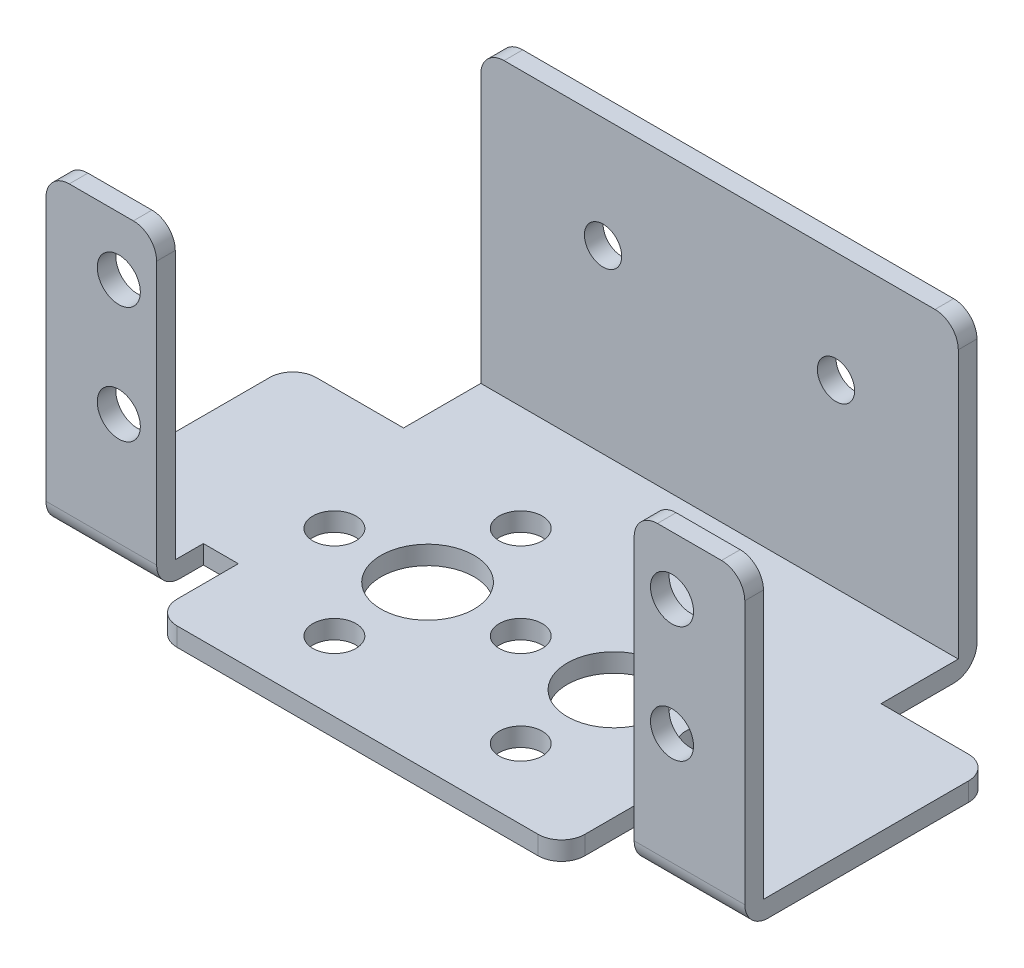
SolidWorks part; units mm, degrees
ref_plane "Front Plane" through (0, 0, 0) normal (0, 0, 1) x (1, 0, 0)
ref_plane "Top Plane" through (0, 0, 0) normal (0, 1, 0) x (1, 0, 0)
ref_plane "Right Plane" through (0, 0, 0) normal (1, 0, 0) x (0, 0, -1)
sketch "Sketch1" plane through (0, 0, 0) normal (0, 1, 0) x (1, 0, 0)
  line L0 (0, 0) -> (0, 21.2)
  line L1 (0, 21.2) -> (9.5, 21.2)
  line L2 (9.5, 21.2) -> (9.5, 29.4307)
  line L3 (9.5, 29.4307) -> (50.5, 29.4307)
  line L4 (50.5, 29.4307) -> (50.5, 21.2)
  line L5 (50.5, 21.2) -> (60, 21.2)
  line L6 (60, 21.2) -> (60, 0)
  line L7 (60, 0) -> (50.5, 0)
  line L8 (50.5, 0) -> (50.5, 4.012)
  line L9 (50.5, 4.012) -> (47.5, 4.012)
  line L10 (47.5, 4.012) -> (47.5, -3.2389)
  line L11 (47.5, -3.2389) -> (12.5, -3.2389)
  line L12 (12.5, -3.2389) -> (12.5, 4.012)
  line L13 (12.5, 4.012) -> (9.5, 4.012)
  line L14 (9.5, 4.012) -> (9.5, 0)
  line L15 (9.5, 0) -> (0, 0)
  dimension "D1" = 21.2
  dimension "D2" = 9.5
  dimension "D3" = 41
  dimension "D4" = 9.5
  dimension "D5" = 21.2
  dimension "D6" = 9.5
  dimension "D7" = 3
  dimension "D8" = 35
  dimension "D9" = 3
extrude "Extrude1" add sketch "Sketch1" along normal blind 1.6
sketch "Sketch2" plane through (0, 1.6, 0) normal (0, 1, 0) x (1, 0, 0)
  line L0 (9.5, 0) -> (9.5, 4.012) construction
  line L1 (0, 0) -> (9.5, 0)
  line L2 (0, 0) -> (0, 1.6)
  line L3 (0, 1.6) -> (9.5, 1.6)
  line L4 (9.5, 0) -> (9.5, 1.6)
  line L5 (60, 0) -> (60, 21.2) construction
  line L6 (50.5, 0) -> (60, 0)
  line L7 (50.5, 0) -> (50.5, 1.6)
  line L8 (50.5, 1.6) -> (60, 1.6)
  line L9 (60, 0) -> (60, 1.6)
  line L10 (50.5, 21.2) -> (50.5, 29.4307) construction
  line L11 (9.5, 29.4307) -> (50.5, 29.4307)
  line L12 (9.5, 29.4307) -> (9.5, 27.8307)
  line L13 (9.5, 27.8307) -> (50.5, 27.8307)
  line L14 (50.5, 29.4307) -> (50.5, 27.8307)
  dimension "D1" = 1.6
  dimension "D2" = 1.6
  dimension "D3" = 1.6
extrude "Extrude2" add sketch "Sketch2" along normal blind 25
sketch "Sketch3" plane through (0, 0, 0) normal (0, 0, 1) x (1, 0, 0)
  line L0 (0, 0) -> (9.5, 0) construction
  line L1 (50.5, 0) -> (60, 0) construction
  line L2 (12.5, 0) -> (47.5, 0) construction
  circle A0 centre (6.25, 21.6) radius 1.85
  circle A1 centre (6.25, 11.6) radius 1.85
  circle A2 centre (53.75, 21.6) radius 1.85
  circle A3 centre (53.75, 11.6) radius 1.85
  point P12 (30, 0)
  point P15 (30, 0)
  dimension "D1" = 3.7
  dimension "D2" = 3.7
  dimension "D3" = 3.7
  dimension "D4" = 3.7
  dimension "D5" = 11.6
  dimension "D6" = 11.6
  dimension "D7" = 10
  dimension "D8" = 10
  dimension "D9" = 23.75
  dimension "D10" = 23.75
extrude "Cut-Extrude1" cut sketch "Sketch3" against normal through all
sketch "Sketch4" plane through (0, 0, -27.8307) normal (0, 0, 1) x (1, 0, 0)
  line L0 (12.5, 0) -> (47.5, 0) construction
  circle A0 centre (20, 17.0945) radius 1.6
  circle A1 centre (40, 17.0945) radius 1.6
  point P4 (30, 0)
  point P7 (30, 0)
  dimension "D1" = 3.2
  dimension "D2" = 3.2
  dimension "D3" = 10
  dimension "D4" = 10
extrude "Cut-Extrude2" cut sketch "Sketch4" against normal blind 25
sketch "Sketch6" plane through (0, 0, 0) normal (0, -1, 0) x (1, 0, 0)
  line L0 (12.5, 3.2389) -> (47.5, 3.2389) construction
  line L1 (12.5, 3.2389) -> (47.5, 3.2389) construction
  circle A2 centre (14, -10.7611) radius 1.85
  point P0 (30, 3.2389)
  point P3 (30, 3.2389)
  dimension "D1" = 8
  dimension "D2" = 8
  dimension "D3" = 14
sketch_block_instance "Block5-1"
sketch_block "Block5"
sketch_block_instance "Block5-2"
extrude "Cut-Extrude3" cut sketch "Sketch6" against normal blind 25
fillet "Fillet1" radius 2 1 edges at (47.5, 0.8, 3.2389)
fillet "Fillet2" radius 2 1 edges at (12.5, 0.8, 3.2389)
fillet "Fillet3" radius 2 1 edges at (60, 26.6, -0.8)
fillet "Fillet4" radius 2 1 edges at (9.5, 26.6, -0.8)
fillet "Fillet5" radius 2 1 edges at (50.5, 26.6, -28.6307)
fillet "Fillet6" radius 2 1 edges at (50.5, 26.6, -0.8)
fillet "Fillet7" radius 2 1 edges at (0, 26.6, -0.8)
fillet "Fillet8" radius 2 1 edges at (9.5, 26.6, -28.6307)
fillet "Fillet9" radius 2 1 edges at (0, 0.8, -21.2)
fillet "Fillet10" radius 2 1 edges at (60, 0.8, -21.2)
fillet "Fillet11" radius 2 1 edges at (30, 0, -29.4307)
fillet "Fillet12" radius 2 1 edges at (55.25, 0, 0)
fillet "Fillet13" radius 2 1 edges at (4.75, 0, 0)
